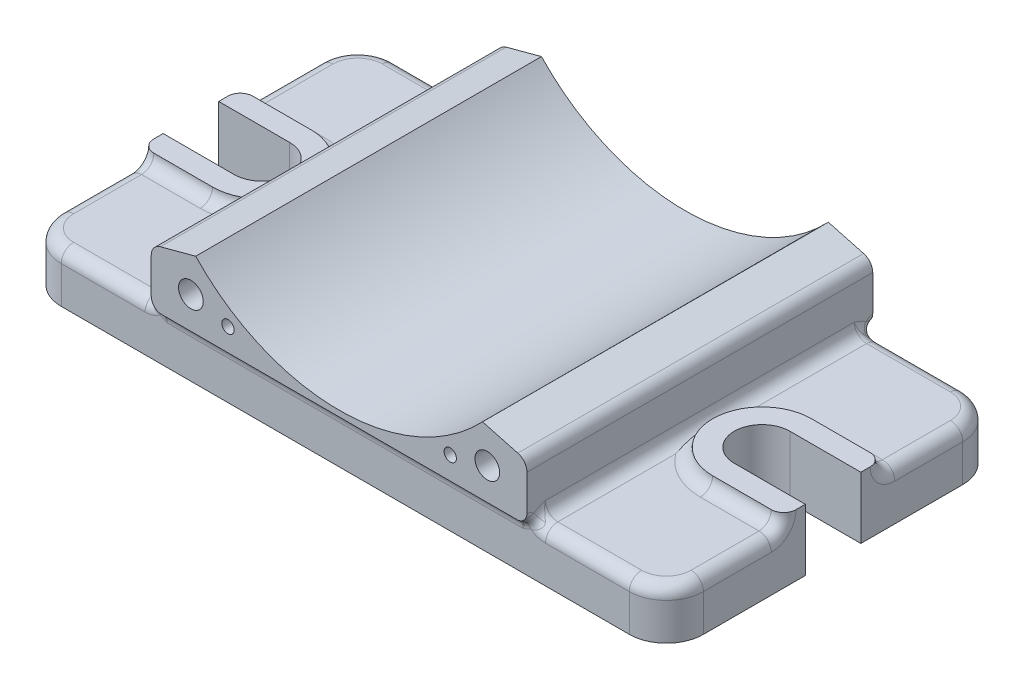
SolidWorks part; units mm, degrees
ref_plane "Front" through (0, 0, 0) normal (0, 0, 1) x (1, 0, 0)
ref_plane "Top" through (0, 0, 0) normal (0, 1, 0) x (1, 0, 0)
ref_plane "Right" through (0, 0, 0) normal (1, 0, 0) x (0, 0, -1)
sketch "Sketch3" plane through (0, 0, 0) normal (0, 1, 0) x (1, 0, 0)
  line L0 (-82.55, 42.8625) -> (82.55, 42.8625)
  line L1 (-82.55, 42.8625) -> (-82.55, -42.8625)
  line L2 (82.55, -42.8625) -> (-82.55, -42.8625)
  line L3 (82.55, -42.8625) -> (82.55, 42.8625)
  line L4 (0, 66.3895) -> (0, -72.7978) construction
  line L5 (-123.8075, 0) -> (144.0576, 0) construction
  dimension "D1" = 165.1
  dimension "D2" = 85.725
extrude "Base-Extrude" add sketch "Sketch3" against normal blind 12.7
sketch "Sketch4" plane through (0, 0, 0) normal (0, 0, 1) x (1, 0, 0)
  line L0 (-48.3014, 0) -> (48.3014, 0)
  line L1 (-48.3014, 0) -> (-48.3014, 14.2875)
  line L3 (48.3014, 14.2875) -> (48.3014, 0)
  line L5 (0, 42.6246) -> (0, -30.4166) construction
  line L6 (82.55, 0) -> (-82.55, 0) construction
  line L7 (-48.3014, 14.2875) -> (-36.8714, 17.3502)
  line L8 (36.8714, 17.3502) -> (48.3014, 14.2875)
  arc A0 (-36.8714, 17.3502) -> (36.8714, 17.3502) centre (0, 52.2949) ccw
  dimension "D1" = 50.8
  dimension "D2" = 75
  dimension "D3" = 96.6029
  dimension "D4" = 11.43
  dimension "D5" = 14.2875
extrude "Boss-Extrude1" add sketch "Sketch4" along normal mid plane 88.9
sketch "Sketch5" plane through (0, 0, 0) normal (0, 1, 0) x (-1, 0, 0)
  line L0 (82.55, -7.1437) -> (64.2937, -7.1437)
  line L1 (82.55, -7.1437) -> (82.55, 7.1437)
  line L2 (64.2937, 7.1437) -> (82.55, 7.1437)
  line L4 (82.55, -42.8625) -> (82.55, 42.8625) construction
  line L5 (85.8318, 0) -> (53.0138, 0) construction
  arc A0 (64.2937, -7.1437) -> (64.2937, 7.1437) centre (64.2937, 0) cw
  dimension "D2" = 25.4
  dimension "D1" = 14.2875
extrude "Cut-Extrude1" cut sketch "Sketch5" against normal through all
sketch "Sketch6" plane through (0, 0, 0) normal (0, 1, 0) x (-1, 0, 0)
  line L0 (82.55, 7.1437) -> (82.55, 42.8625) construction
  line L1 (64.2937, 7.1437) -> (82.55, 7.1437) construction
  line L2 (82.55, -42.8625) -> (82.55, -7.1437) construction
  line L6 (82.55, -12.7) -> (64.2937, -12.7)
  line L7 (64.2937, 12.7) -> (82.55, 12.7)
  line L9 (82.55, -7.1437) -> (64.2937, -7.1437) construction
  line L10 (82.55, 7.1437) -> (82.55, 12.7)
  line L11 (64.2937, 7.1437) -> (82.55, 7.1437)
  line L12 (82.55, -12.7) -> (82.55, -7.1437)
  line L13 (82.55, -7.1437) -> (64.2937, -7.1437)
  arc A0 (64.2937, 7.1437) -> (64.2937, -7.1437) centre (64.2937, 0) ccw construction
  arc A2 (64.2937, 12.7) -> (64.2937, -12.7) centre (64.2937, 0) ccw
  arc A3 (64.2937, 7.1437) -> (64.2937, -7.1437) centre (64.2937, 0) ccw
  dimension "D1" = 25.4
extrude "Boss-Extrude2" add sketch "Sketch6" along normal blind 3.175
other "Hole1" parameters "D1"=20.6375
sketch "Sketch7" plane through (0, 0, 44.45) normal (0, 0, 1) x (1, 0, 0)
  line L0 (0, -50) -> (0, 50) construction
  line L1 (82.55, -12.7) -> (-82.55, -12.7) construction
  circle A0 centre (-38.1, 8.2031) radius 3.175
  dimension "D1" = 6.35
  dimension "D3" = 20.9031
  dimension "D2" = 38.1
other "Hole2" parameters "D1"=14.2875
sketch "Sketch8" plane through (0, 0, 44.45) normal (0, 0, 1) x (1, 0, 0)
  line L0 (-48.3014, 0) -> (-48.3014, 14.2875) construction
  line L1 (82.55, -12.7) -> (-82.55, -12.7) construction
  circle A0 centre (-28.575, 5.8219) radius 1.5875
  dimension "D1" = 3.175
  dimension "D2" = 19.7264
  dimension "D3" = 18.5219
mirror "Mirror1" about plane through (0, 0, 0) normal (1, 0, 0) of "Boss-Extrude2", "Cut-Extrude1"
mirror "Mirror2" about plane through (0, 0, 0) normal (1, 0, 0) of "Hole2", "Hole1"
mirror "Mirror3" about plane through (0, 0, 0) normal (0, 0, 1) of "Hole1", "Hole2", "Mirror2"
fillet "Fillet1" radius 3.175 4 edges at (-48.3014, 0, 0) (48.3014, 0, 0) (-48.3014, 14.2875, 0) (48.3014, 14.2875, 0)
fillet "Fillet2" radius 3.175 6 edges at (0, 0, 42.8625) (0, 0, -42.8625) (-48.3014, 0, 43.6562) (-48.3014, 0, -43.6562) (48.3014, 0, 43.6562) (48.3014, 0, -43.6562)
fillet "Fillet3" radius 3.175 14 edges at (-82.55, 1.5875, 12.7) (-51.5937, 0, 0) (-64.2937, 1.5875, 12.7) (-64.2937, 1.5875, -12.7) (-82.55, 1.5875, -12.7) (-73.4219, 0, -12.7) (-73.4219, 0, 12.7) (73.4219, 0, -12.7) (82.55, 1.5875, -12.7) (64.2937, 1.5875, -12.7) (73.4219, 0, 12.7) (64.2937, 1.5875, 12.7) (82.55, 1.5875, 12.7) (51.5937, 0, 0)
fillet "Fillet4" radius 9.525 4 edges at (-82.55, -6.35, -42.8625) (82.55, -6.35, -42.8625) (82.55, -6.35, 42.8625) (-82.55, -6.35, 42.8625)
fillet "Fillet5" radius 3.175 20 edges at (62.2507, 0, -42.8625) (-62.2507, 0, 42.8625) (49.2314, 0.9299, -42.8625) (49.2314, 0.9299, 42.8625) (-49.2314, 0.9299, -42.8625) (-49.2314, 0.9299, 42.8625) (-82.55, 0, 24.6062) (82.55, 0, -24.6062) (-82.55, 0.9299, -13.6299) (82.55, 0.9299, -13.6299) (-82.55, 0.9299, 13.6299) (82.55, 0.9299, 13.6299) (-79.7602, 0, 40.0727) (62.2507, 0, 42.8625) (-62.2507, 0, -42.8625) (-82.55, 0, -24.6062) (-79.7602, 0, -40.0727) (79.7602, 0, -40.0727) (82.55, 0, 24.6062) (79.7602, 0, 40.0727)
fillet "Fillet9" radius 2.54 10 edges at (48.3014, -2.5369, 42.8625) (-48.3014, -2.5369, -42.8625) (-48.3014, -1.1621, 43.2879) (48.3014, -1.1621, 43.2879) (48.3014, -1.1621, -43.2879) (-48.3014, -1.1621, -43.2879) (-48.3014, -2.5369, 42.8625) (48.3014, -2.5369, -42.8625) (-48.3014, -0.7368, -42.5788) (48.3014, -0.7368, 42.5788)
fillet "Fillet10" radius 2.54 12 edges at (47.716, -0.4457, 42.6547) (-47.6535, -0.5226, 42.6903) (47.6535, -0.5226, -42.6903) (-47.716, -0.4457, -42.6547)
